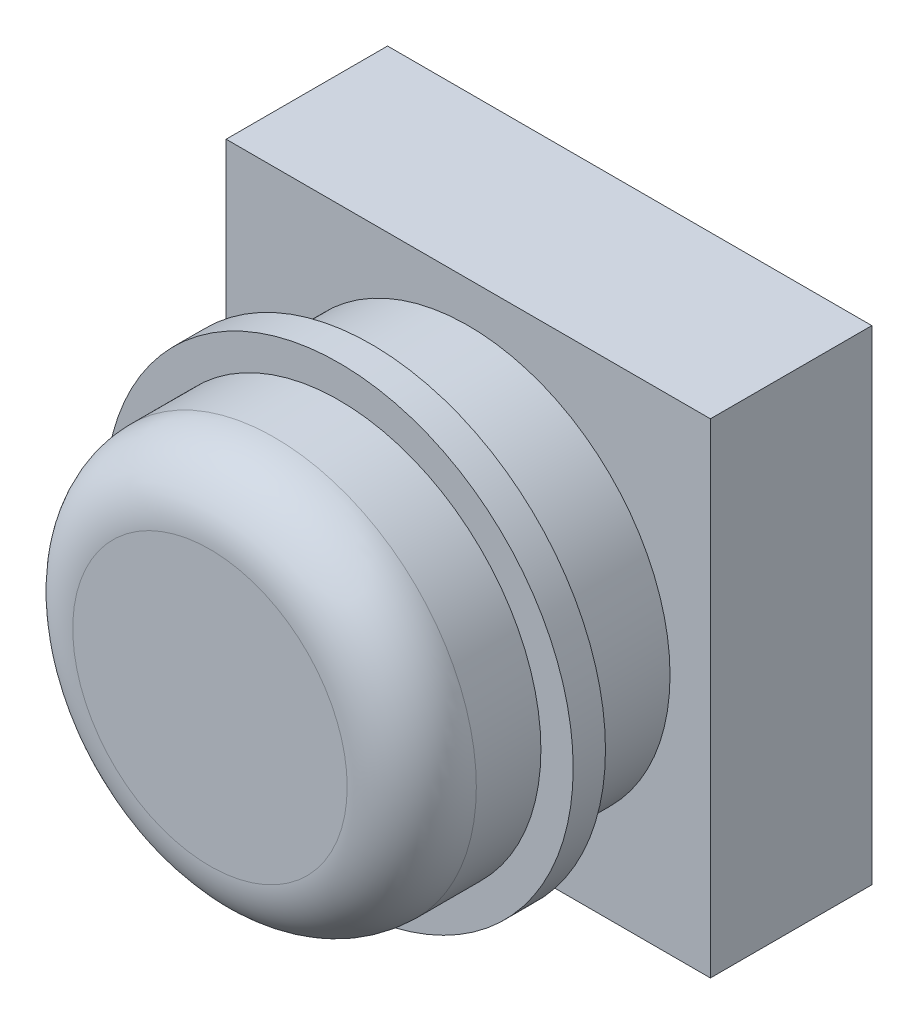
SolidWorks part; units mm, degrees
ref_plane "Front" through (0, 0, 0) normal (0, 0, 1) x (1, 0, 0)
ref_plane "Top" through (0, 0, 0) normal (0, 1, 0) x (1, 0, 0)
ref_plane "Right" through (0, 0, 0) normal (1, 0, 0) x (0, 0, -1)
sketch "Sketch1" plane through (0, 0, 0) normal (0, 0, 1) x (1, 0, 0)
  line L0 (-7.5, 7.5) -> (7.5, 7.5)
  line L1 (-7.5, 7.5) -> (-7.5, -7.5)
  line L2 (7.5, -7.5) -> (-7.5, -7.5)
  line L3 (7.5, -7.5) -> (7.5, 7.5)
  line L4 (-7.5, -7.5) -> (7.5, 7.5) construction
  line L5 (-7.5, 7.5) -> (7.5, -7.5) construction
  point P4 (0, 0)
  dimension "D1" = 15
  dimension "D2" = 15
extrude "Base-Extrude" add sketch "Sketch1" along normal blind 5
sketch "Sketch2" plane through (0, 0, 5) normal (0, 0, 1) x (1, 0, 0)
  circle A0 centre (0, 0) radius 6.25
  dimension "D1" = 12.5
extrude "Boss-Extrude1" add sketch "Sketch2" along normal blind 8
fillet "Fillet2" radius 2
ref_plane "Plane4" through (0, 0, 8) normal (0, 0, 1) x (1, 0, 0)
sketch "Sketch4" plane through (0, 0, 8) normal (0, 0, 1) x (1, 0, 0)
  circle A0 centre (0, 0) radius 6.25 construction
  circle A1 centre (0, 0) radius 6.25
  circle A3 centre (0, 0) radius 7.25
  circle A4 centre (0, 0) radius 7.25
  dimension "D1" = 1
extrude "Boss-Extrude2" add sketch "Sketch4" along normal blind 1
